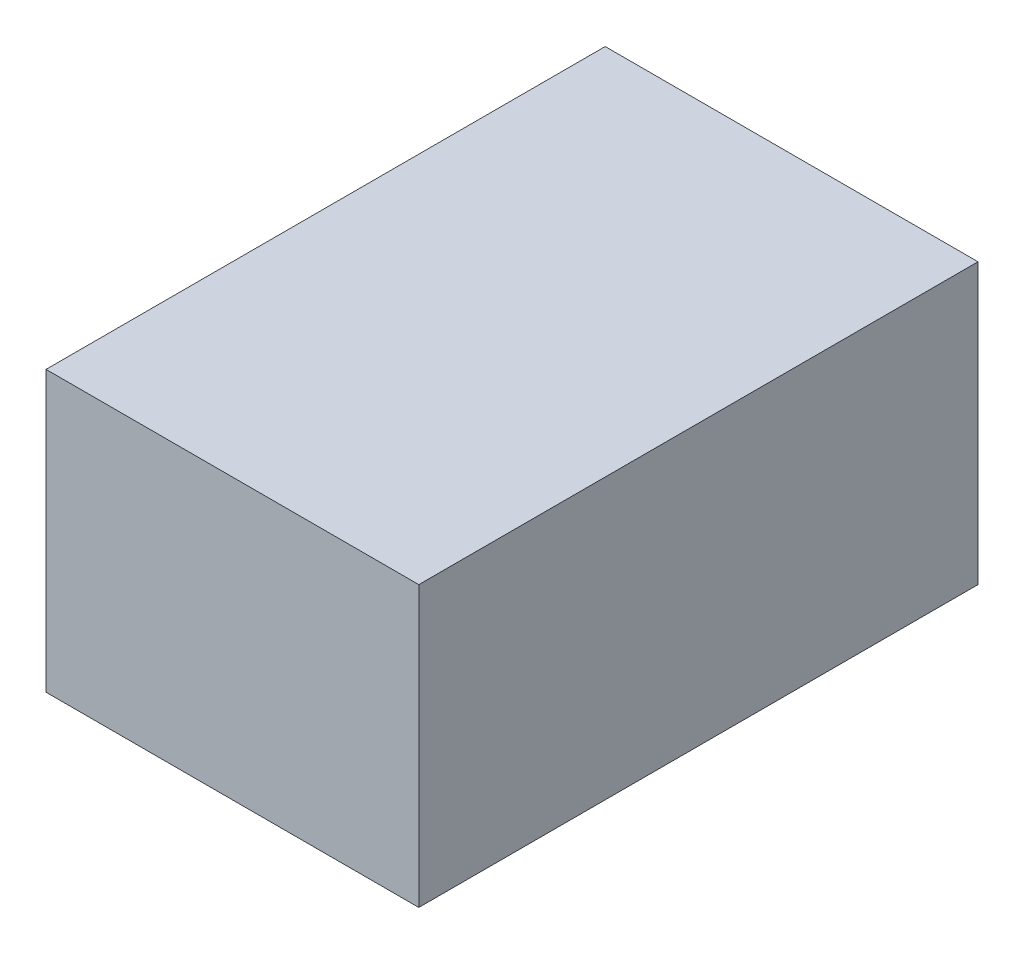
SolidWorks part; units mm, degrees
ref_plane "前视基准面" through (0, 0, 0) normal (0, 0, 1) x (1, 0, 0)
ref_plane "上视基准面" through (0, 0, 0) normal (0, 1, 0) x (1, 0, 0)
ref_plane "右视基准面" through (0, 0, 0) normal (1, 0, 0) x (0, 0, -1)
sketch "草图1" plane through (0, 0, 0) normal (1, 0, 0) x (0, 0, -1)
  line L1 (-15, -7.5) -> (15, -7.5)
  line L2 (-15, -7.5) -> (-15, 7.5)
  line L3 (-15, 7.5) -> (15, 7.5)
  line L4 (15, -7.5) -> (15, 7.5)
  line L5 (-15, -7.5) -> (15, 7.5) construction
  line L6 (-15, 7.5) -> (15, -7.5) construction
  point P0 (0, 0)
  dimension "D1" = 30
  dimension "D2" = 15
extrude "凸台-拉伸1" add sketch "草图1" along normal blind 20
ref_plane "基准面1" through (0, 0, 10) normal (0, 0, 1) x (1, 0, 0)
